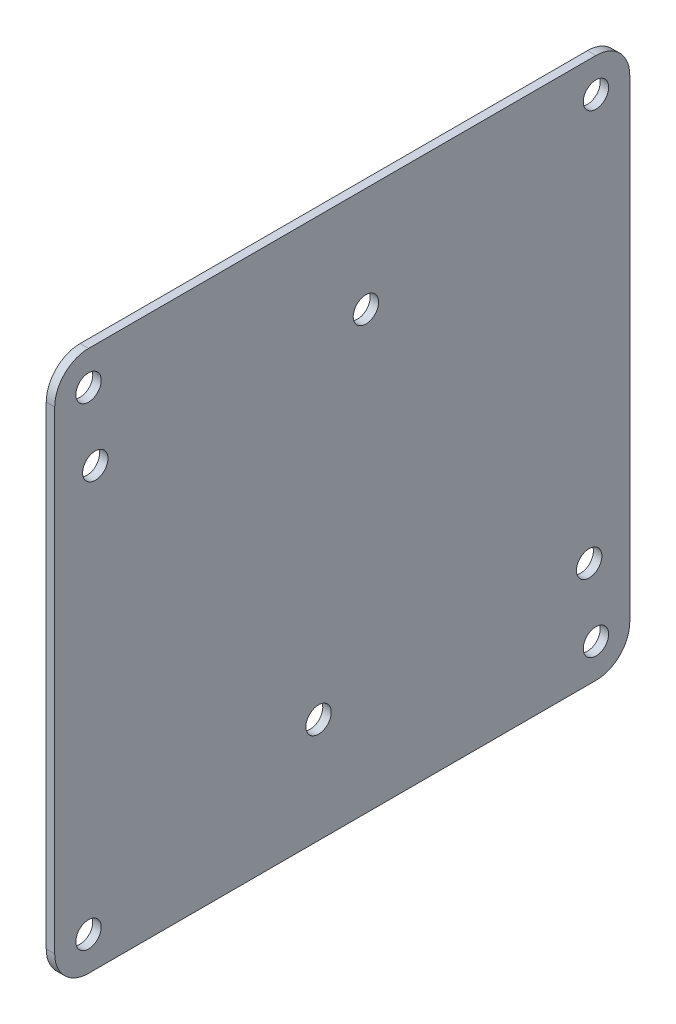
SolidWorks part; units mm, degrees
ref_plane "Front Plane" through (0, 0, 0) normal (0, 0, 1) x (1, 0, 0)
ref_plane "Top Plane" through (0, 0, 0) normal (0, 1, 0) x (1, 0, 0)
ref_plane "Right Plane" through (0, 0, 0) normal (1, 0, 0) x (0, 0, -1)
sketch "Sketch1" plane through (0, 0, 0) normal (1, 0, 0) x (0, 0, -1)
  line L1 (-53.975, 50.8) -> (53.975, 50.8)
  line L2 (-53.975, 50.8) -> (-53.975, -50.8)
  line L3 (-53.975, -50.8) -> (53.975, -50.8)
  line L4 (53.975, 50.8) -> (53.975, -50.8)
  line L5 (-53.975, 50.8) -> (53.975, -50.8) construction
  line L6 (-53.975, -50.8) -> (53.975, 50.8) construction
  line L7 (-47.625, -44.45) -> (47.625, -44.45) construction
  line L8 (-47.625, -44.45) -> (-47.625, 44.45) construction
  line L9 (-47.625, 44.45) -> (47.625, 44.45) construction
  line L10 (47.625, -44.45) -> (47.625, 44.45) construction
  line L11 (-47.625, -44.45) -> (47.625, 44.45) construction
  line L12 (-47.625, 44.45) -> (47.625, -44.45) construction
  circle A0 centre (-47.625, 44.45) radius 2.3812
  circle A1 centre (47.625, 44.45) radius 2.3812
  circle A2 centre (47.625, -44.45) radius 2.3812
  circle A3 centre (-47.625, -44.45) radius 2.3812
  point P0 (0, 0)
  point P6 (0, 0)
  dimension "D4" = 4.7625
  dimension "D1" = 107.95
  dimension "D2" = 101.6
  dimension "D3" = 6.35
  dimension "D5" = 6.35
extrude "Boss-Extrude1" add sketch "Sketch1" along normal blind 1.5875
fillet "Fillet1" radius 6.35 4 edges at (0.7937, -50.8, 53.975) (0.7937, -50.8, -53.975) (0.7937, 50.8, -53.975) (0.7937, 50.8, 53.975)
sketch "Sketch2" plane through (1.5875, 0, 0) normal (1, 0, 0) x (0, 0, -1)
  line L0 (-53.975, 44.45) -> (-53.975, -44.45) construction
  line L1 (-46.355, 31.115) -> (-4.445, 31.115) construction
  line L2 (-46.355, 31.115) -> (-46.355, -31.115) construction
  line L3 (-46.355, -31.115) -> (-4.445, -31.115) construction
  line L4 (-4.445, 31.115) -> (-4.445, -31.115) construction
  line L5 (-46.355, 31.115) -> (-4.445, -31.115) construction
  line L6 (-46.355, -31.115) -> (-4.445, 31.115) construction
  line L7 (53.975, -44.45) -> (53.975, 44.45) construction
  line L8 (4.445, 31.115) -> (46.355, 31.115) construction
  line L9 (4.445, 31.115) -> (4.445, -31.115) construction
  line L10 (4.445, -31.115) -> (46.355, -31.115) construction
  line L11 (46.355, 31.115) -> (46.355, -31.115) construction
  line L12 (4.445, 31.115) -> (46.355, -31.115) construction
  line L13 (4.445, -31.115) -> (46.355, 31.115) construction
  circle A0 centre (-46.355, 31.115) radius 2.3812
  circle A1 centre (-4.445, -31.115) radius 2.3813
  circle A2 centre (4.445, 31.115) radius 2.3812
  circle A3 centre (46.355, -31.115) radius 2.3812
  point P0 (-25.4, 0)
  point P8 (25.4, 0)
  dimension "D7" = 4.7625
  dimension "D1" = 41.91
  dimension "D2" = 62.23
  dimension "D3" = 28.575
  dimension "D4" = 41.91
  dimension "D5" = 62.23
  dimension "D6" = 28.575
extrude "Cut-Extrude1" cut sketch "Sketch2" against normal blind 1.5875
